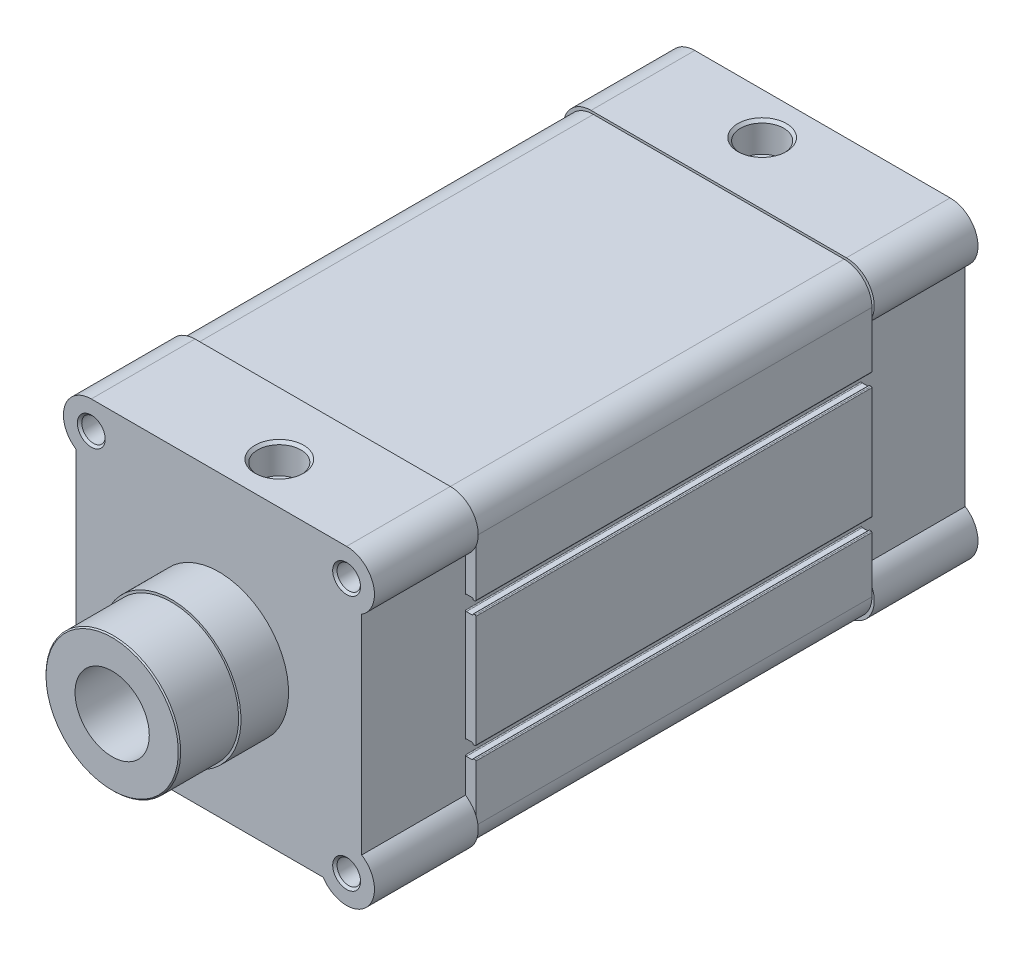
SolidWorks part; units mm, degrees
ref_plane "Frontal" through (0, 0, 0) normal (0, 0, 1) x (1, 0, 0)
ref_plane "Horizontal" through (0, 0, 0) normal (0, 1, 0) x (1, 0, 0)
ref_plane "Vertical" through (0, 0, 0) normal (1, 0, 0) x (0, 0, -1)
imported_body "Importée1"
hole_wizard "Trou taraudé M121" positions "Esquisse2" profile "Esquisse1" tap size "M12" standard "ISO"
sketch "Esquisse2" plane through (0, 0, -260) normal (0, 0, -1) x (-1, 0, 0)
  point P1 (55, -55)
  point P4 (55, 55)
  point P7 (-55, 55)
  point P10 (-55, -55)
sketch "Esquisse1" plane through (-55, -55, -260) normal (1, 0, 0) x (0, 1, 0)
  line L0 (0, 0) -> (0, 55.8144)
  line L1 (0, 55.8144) -> (5.1, 52.75)
  line L2 (5.1, 52.75) -> (5.1, 0)
  line L5 (5.1, 0) -> (0, 0)
  line L10 (0, 55.8144) -> (-5.1, 52.75) construction
  line L11 (0, -6.35) -> (0, 107.95) construction
  dimension "Diamètre du trou pour taraudage" = 10.2
  dimension "Profondeur du trou pour taraudage" = 52.75
  dimension "Angle de pointe" = 118
